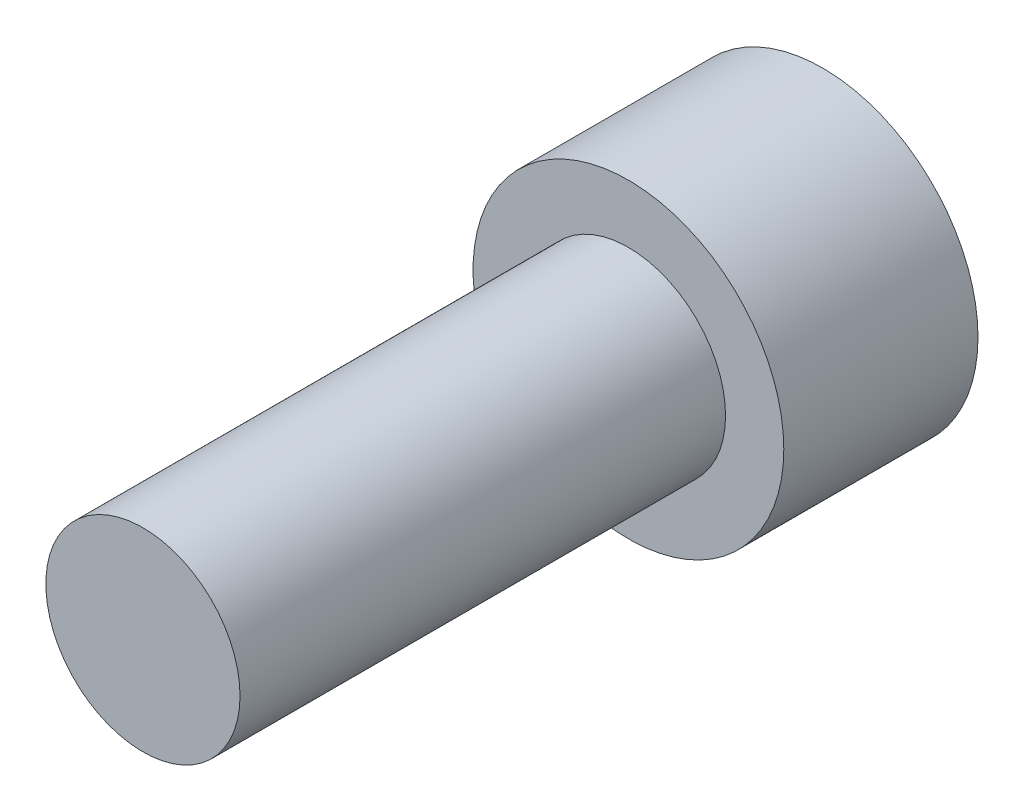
SolidWorks part; units mm, degrees
ref_plane "Front Plane" through (0, 0, 0) normal (0, 0, 1) x (1, 0, 0)
ref_plane "Top Plane" through (0, 0, 0) normal (0, 1, 0) x (1, 0, 0)
ref_plane "Right Plane" through (0, 0, 0) normal (1, 0, 0) x (0, 0, -1)
sketch "Sketch6" plane through (0, 0, 0) normal (1, 0, 0) x (0, 0, -1)
  line L0 (-25, 0) -> (22.525, 0) construction
  line L1 (8.8, 0) -> (-8.8, 0) construction
  line L2 (-25, 0) -> (-25, -5)
  line L3 (-25, -5) -> (0, -5)
  line L4 (0, 8.8) -> (0, -8.8) construction
  line L5 (0, -5) -> (0, -8)
  line L6 (0, -8) -> (10, -8)
  line L7 (10, -8) -> (10, 0)
  line L8 (10, 0) -> (-25, 0)
  dimension "L" = 25
  dimension "H" = 10
  dimension "A" = 16
  dimension "D" = 10
revolve "Revolve1" add sketch "Sketch6" angle 360 about L0
sketch "Sketch7" plane through (0, 0, -10) normal (0, 0, -1) x (-1, 0, 0)
  line L2 (-4, 2.3094) -> (-4, -2.3094)
  line L4 (-4, -2.3094) -> (0, -4.6188)
  line L5 (0, -4.6188) -> (4, -2.3094)
  line L6 (4, -2.3094) -> (4, 2.3094)
  line L7 (4, 2.3094) -> (0, 4.6188)
  line L8 (0, 4.6188) -> (-4, 2.3094)
  circle A0 centre (0, 0) radius 4 construction
  dimension "J" = 8
extrude "HEX" cut sketch "Sketch7" against normal blind 8
